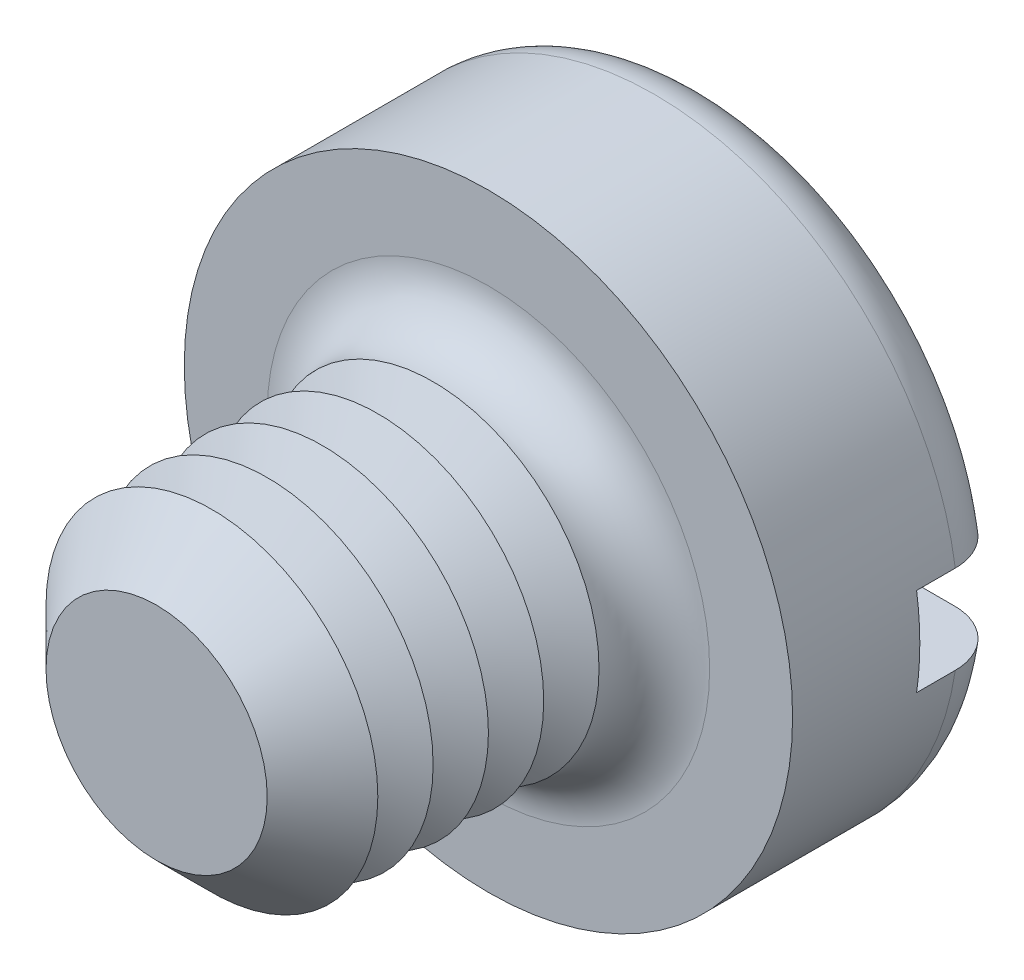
SolidWorks part; units mm, degrees
ref_plane "Front Plane" through (0, 0, 0) normal (0, 0, 1) x (1, 0, 0)
ref_plane "Top Plane" through (0, 0, 0) normal (0, 1, 0) x (1, 0, 0)
ref_plane "Right Plane" through (0, 0, 0) normal (1, 0, 0) x (0, 0, -1)
sketch "Sketch3" plane through (0, 0, 0) normal (0, 0, 1) x (1, 0, 0)
  circle A0 centre (0, 0) radius 2.75
  dimension "D1" = 5.5
extrude "Boss-Extrude2" add sketch "Sketch3" against normal blind 2
sketch "Sketch4" plane through (0, 0, 0) normal (0, 0, 1) x (1, 0, 0)
  circle A0 centre (0, 0) radius 1.5
  dimension "D1" = 3
extrude "Boss-Extrude3" add sketch "Sketch4" along normal blind 3
fillet "Fillet1" radius 0.5 2 edges at (2.75, 0, -2) (1.5, 0, 0)
chamfer "Chamfer1" distance 0.5 angle 45 1 edges at (1.5, 0, 3)
sketch "Sketch5" plane through (0, 0, 0) normal (1, 0, 0) x (0, 0, -1)
  line L0 (1.6944, 0) -> (-7.6738, 0) construction
sketch "Sketch6" plane through (0, 0, 0) normal (1, 0, 0) x (0, 0, -1)
  line L0 (-0.5, 1.5) -> (-0.75, 1.067)
  line L1 (-0.75, 1.067) -> (-1, 1.5)
  line L2 (-0.5, 1.5) -> (-2.5, 1.5) construction
  line L3 (-1, 1.5) -> (-0.5, 1.5)
  dimension "D1" = 0.5
revolve "Cut-Revolve1" cut sketch "Sketch6" angle 360 about L0
pattern_linear "LPattern1" count 4 spacing 0.5 along (0, 0, 1) of "Cut-Revolve1"
sketch "Sketch8" plane through (0, 0, -2) normal (0, 0, -1) x (-1, 0, 0)
  line L1 (2.75, -0.4) -> (-2.75, -0.4)
  line L2 (2.75, -0.4) -> (2.75, 0.4)
  line L3 (2.75, 0.4) -> (-2.75, 0.4)
  line L4 (-2.75, -0.4) -> (-2.75, 0.4)
  line L5 (2.75, -0.4) -> (-2.75, 0.4) construction
  line L6 (2.75, 0.4) -> (-2.75, -0.4) construction
  point P0 (0, 0)
  dimension "D1" = 5.5
  dimension "D2" = 0.8
extrude "Cut-Extrude1" cut sketch "Sketch8" against normal blind 0.85
